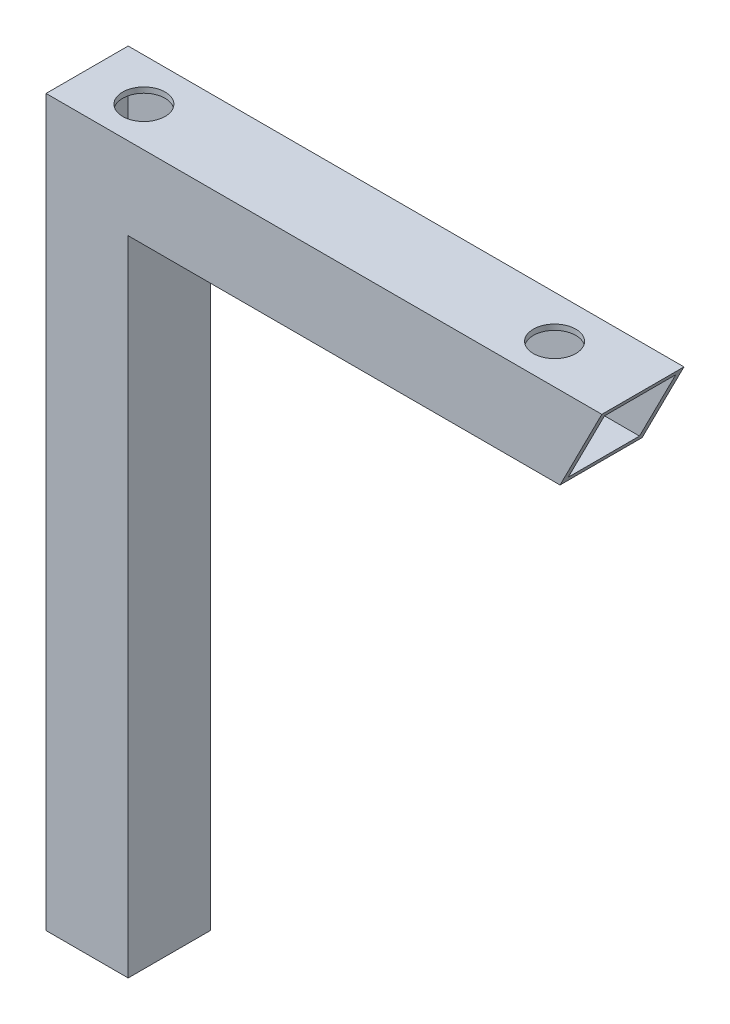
SolidWorks part; units mm, degrees
ref_plane "Plan de face" through (0, 0, 0) normal (0, 0, 1) x (1, 0, 0)
ref_plane "Plan de dessus" through (0, 0, 0) normal (0, 1, 0) x (1, 0, 0)
ref_plane "Plan de droite" through (0, 0, 0) normal (1, 0, 0) x (0, 0, -1)
sketch "Esquisse1" plane through (0, 0, 0) normal (0, 0, 1) x (1, 0, 0)
  line L1 (14.7793, -143.5158) -> (-15.2207, -143.5158)
  line L2 (14.7793, -143.5158) -> (14.7793, 91.2842)
  line L3 (187.7793, 121.2842) -> (-15.2207, 121.2842)
  line L4 (-15.2207, -143.5158) -> (-15.2207, 121.2842)
  line L5 (14.7793, 91.2842) -> (172.5133, 91.2842)
  line L6 (172.5133, 91.2842) -> (187.7793, 121.2842)
  point P0 (0, 0)
  dimension "D1" = 30
  dimension "D2" = 264.8
  dimension "D3" = 203
  dimension "D4" = 30
  dimension "D5" = 116.97
extrude "Boss.-Extru.1" add sketch "Esquisse1" along normal blind 30
shell "Coque1" thickness 2
sketch "Esquisse2" plane through (0, -143.5158, 0) normal (0, -1, 0) x (1, 0, 0)
  line L0 (-15.2207, 30) -> (-15.2207, 0) construction
  line L1 (12.7793, 28) -> (-13.2207, 28)
  line L2 (12.7793, 28) -> (12.7793, 2)
  line L3 (12.7793, 2) -> (-13.2207, 2)
  line L4 (-13.2207, 28) -> (-13.2207, 2)
  line L5 (-15.2207, 0) -> (14.7793, 0) construction
  line L6 (14.7793, 30) -> (14.7793, 0) construction
  line L7 (-15.2207, 30) -> (14.7793, 30) construction
  dimension "D1" = 2
  dimension "D2" = 2
  dimension "D3" = 2
  dimension "D4" = 2
extrude "Enlèv. mat.-Extru.1" cut sketch "Esquisse2" against normal blind 30
hole_wizard "Dégagement M141" positions "Esquisse4" profile "Esquisse3" hole size "M14" standard "ISO"
sketch "Esquisse4" plane through (0, 121.2842, 0) normal (0, 1, 0) x (1, 0, 0)
  line L0 (187.7793, -30) -> (187.7793, 0) construction
  point P0 (156.0693, -15.5433)
  point P2 (6.0693, -15.5433)
  dimension "D1" = 31.71
  dimension "D2" = 150
sketch "Esquisse3" plane through (156.0693, 121.2842, 15.5433) normal (1, 0, 0) x (0, 0, 1)
  line L0 (0, 0) -> (0, 264.8)
  line L1 (0, 264.8) -> (7.75, 264.8)
  line L2 (7.75, 264.8) -> (7.75, 0)
  line L5 (7.75, 0) -> (0, 0)
  line L11 (0, -6.35) -> (0, 107.95) construction
  dimension "Diamètre du perçage jusqu'au prochain" = 15.5
  dimension "Profondeur du perçage jusqu'au prochain" = 264.8
